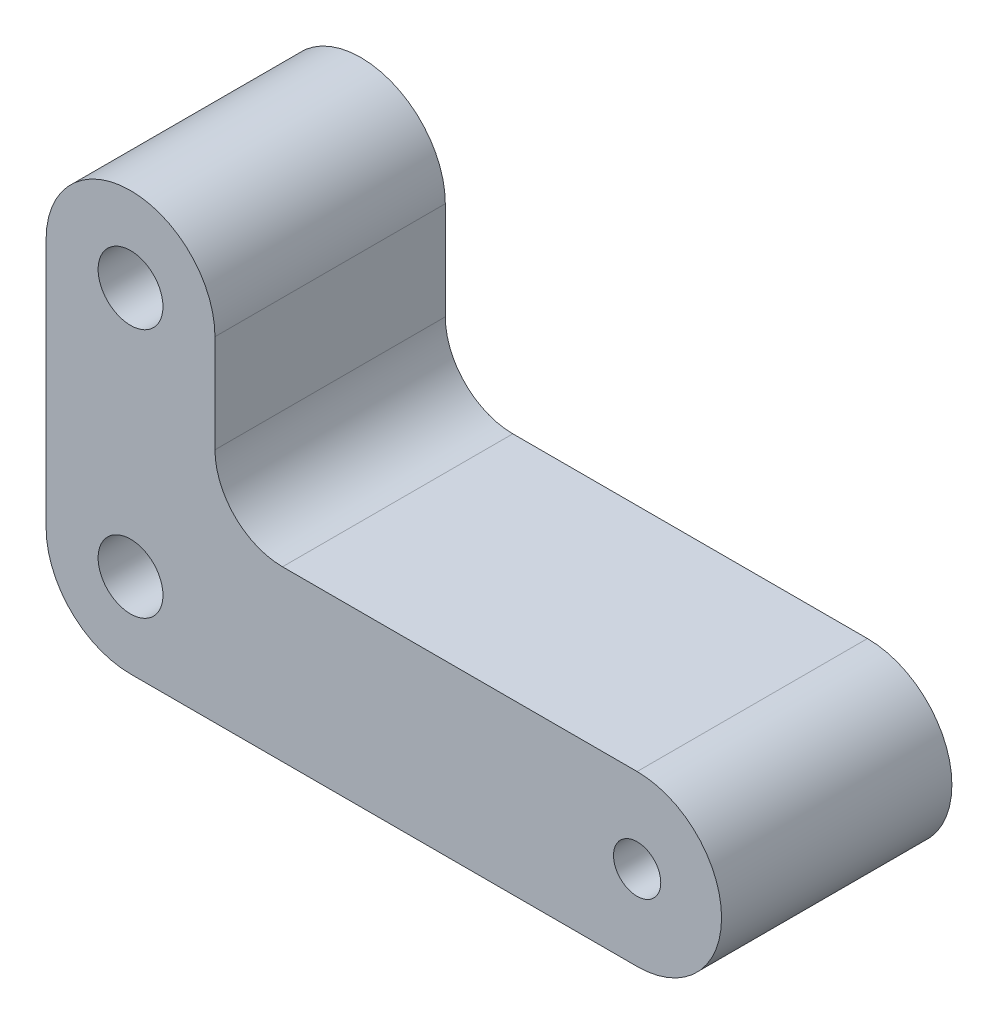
SolidWorks part; units mm, degrees
ref_plane "Front Plane" through (0, 0, 0) normal (0, 0, 1) x (1, 0, 0)
ref_plane "Top Plane" through (0, 0, 0) normal (0, 1, 0) x (1, 0, 0)
ref_plane "Right Plane" through (0, 0, 0) normal (1, 0, 0) x (0, 0, -1)
sketch "Sketch1" plane through (0, 0, 0) normal (0, 0, 1) x (1, 0, 0)
  line L0 (95.25, 31.877) -> (76.2, 31.877)
  line L1 (73.025, 35.052) -> (73.025, 44.45)
  line L2 (79.375, 44.45) -> (79.375, 40.767)
  line L3 (81.915, 38.227) -> (95.25, 38.227)
  arc A0 (79.375, 44.45) -> (73.025, 44.45) centre (76.2, 44.45) ccw
  arc A1 (73.025, 35.052) -> (76.2, 31.877) centre (76.2, 35.052) ccw
  arc A2 (95.25, 31.877) -> (95.25, 38.227) centre (95.25, 35.052) ccw
  arc A3 (79.375, 40.767) -> (81.915, 38.227) centre (81.915, 40.767) ccw
  dimension "D1" = 6.35
  dimension "D3" = 2.54
  dimension "D2" = 19.05
extrude "Boss-Extrude1" add sketch "Sketch1" along normal blind 8.6614
hole_wizard "#2 Clearance Hole1" positions "Sketch3" profile "Sketch2" hole size "#2" standard "ANSI Inch"
sketch "Sketch3" plane through (0, 0, 8.6614) normal (0, 0, 1) x (1, 0, 0)
  point P0 (76.2, 44.45)
  point P3 (76.2, 35.052)
sketch "Sketch2" plane through (76.2, 44.45, 8.6614) normal (1, 0, 0) x (0, -1, 0)
  line L0 (0, 0) -> (0, 8.6614)
  line L1 (0, 8.6614) -> (1.2192, 8.6614)
  line L2 (1.2192, 8.6614) -> (1.2192, 0)
  line L5 (1.2192, 0) -> (0, 0)
  line L11 (0, -6.35) -> (0, 107.95) construction
  dimension "Thru Hole Dia." = 2.4384
  dimension "Thru Hole Depth" = 8.6614
hole_wizard "#2-56 Tapped Hole1" positions "Sketch5" profile "Sketch4" tap size "#2-56" standard "ANSI Inch"
sketch "Sketch5" plane through (0, 0, 8.6614) normal (0, 0, 1) x (1, 0, 0)
  point P0 (95.25, 35.052)
sketch "Sketch4" plane through (95.25, 35.052, 8.6614) normal (1, 0, 0) x (0, -1, 0)
  line L0 (0, 0) -> (0, 8.6614)
  line L1 (0, 8.6614) -> (0.889, 8.6614)
  line L2 (0.889, 8.6614) -> (0.889, 0)
  line L5 (0.889, 0) -> (0, 0)
  line L11 (0, -6.35) -> (0, 107.95) construction
  dimension "Thread Major Dia." = 1.778
  dimension "Thru Tap Drill Depth" = 8.6614
